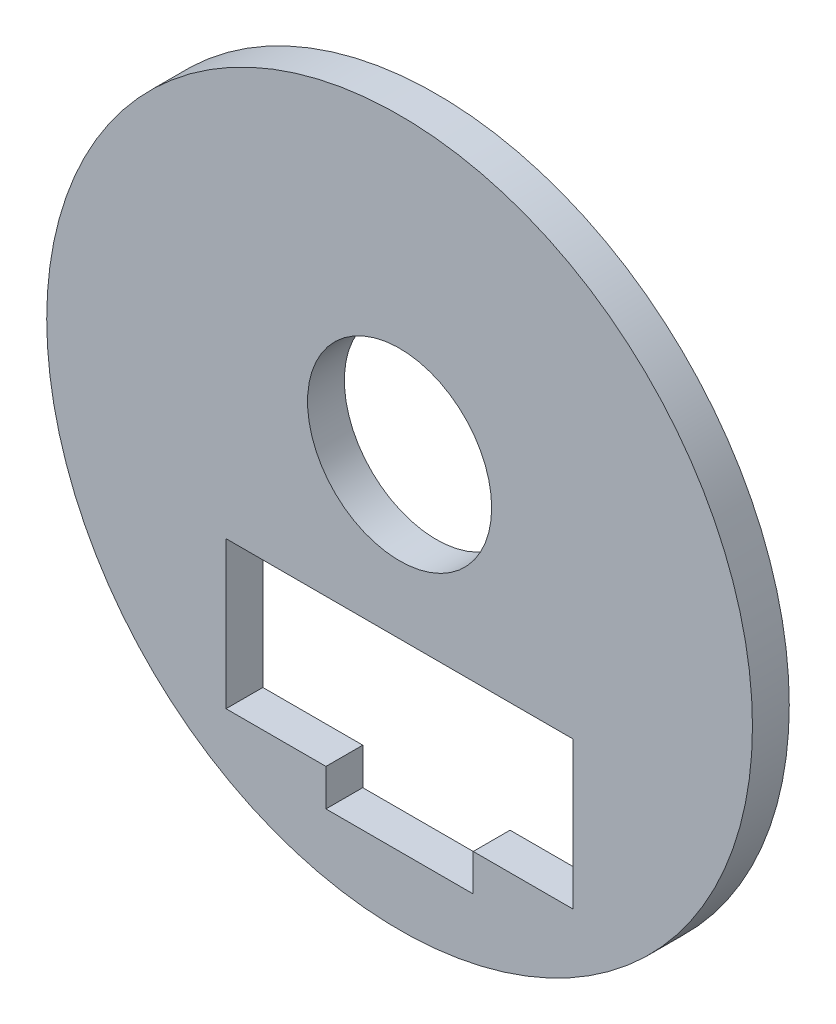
SolidWorks part; units mm, degrees
ref_plane "Front Plane" through (0, 0, 0) normal (0, 0, 1) x (1, 0, 0)
ref_plane "Top Plane" through (0, 0, 0) normal (0, 1, 0) x (1, 0, 0)
ref_plane "Right Plane" through (0, 0, 0) normal (1, 0, 0) x (0, 0, -1)
sketch "Sketch1" plane through (0, 0, 0) normal (0, 0, 1) x (1, 0, 0)
  circle A0 centre (0, 0) radius 36.5125
  dimension "D1" = 73.025
extrude "Extrude1" add sketch "Sketch1" against normal blind 3.81
sketch "Sketch2" plane through (0, 0, 0) normal (0, 0, 1) x (1, 0, 0)
  circle A0 centre (0, 6.096) radius 9.525
  dimension "D1" = 19.05
  dimension "D2" = 6.096
extrude "Cut-Extrude1" cut sketch "Sketch2" against normal through all
sketch "Sketch3" plane through (0, 0, 0) normal (0, 0, 1) x (1, 0, 0)
  line L0 (-28.627, 0) -> (27.711, 0) construction
  line L1 (0, 6.096) -> (-28.627, 6.096) construction
  line L2 (-17.9578, -10.414) -> (17.9578, -10.414)
  line L3 (0, 27.9782) -> (0, -36.5125) construction
  line L4 (-17.9578, -10.414) -> (-17.9578, -25.654)
  line L5 (-17.9578, -25.654) -> (17.9578, -25.654)
  line L6 (17.9578, -25.654) -> (17.9578, -10.414)
  circle A0 centre (0, 0) radius 36.5125 construction
  dimension "D1" = 35.9156
  dimension "D2" = 17.9578
  dimension "D3" = 16.51
  dimension "D4" = 15.24
extrude "Cut-Extrude10" cut sketch "Sketch3" against normal through all
sketch "Sketch4" plane through (0, 0, -3.81) normal (0, 0, -1) x (-1, 0, 0)
  line L0 (0, 0) -> (0, -30.6193) construction
  line L1 (0, 6.096) -> (-13.752, 6.096) construction
  line L2 (7.62, -29.464) -> (-7.62, -29.464)
  line L3 (7.62, -29.464) -> (7.62, -25.654)
  line L4 (7.62, -25.654) -> (-7.62, -25.654)
  line L5 (-7.62, -29.464) -> (-7.62, -25.654)
  point P7 (0, -25.654)
  dimension "D1" = 15.24
  dimension "D2" = 3.81
  dimension "D3" = 31.75
extrude "Cut-Extrude11" cut sketch "Sketch4" against normal through all
